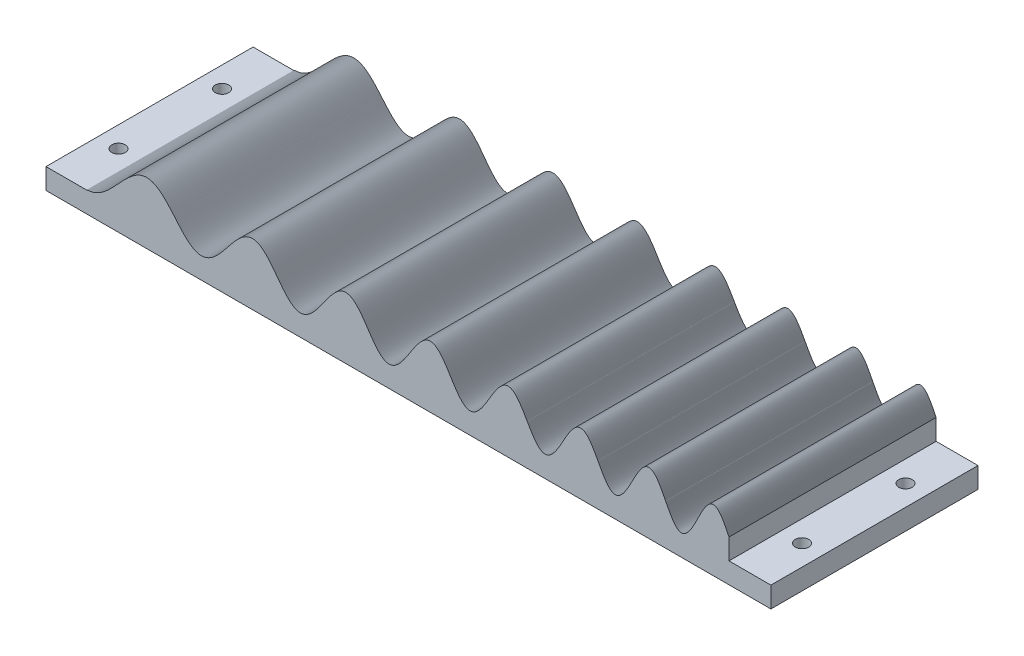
SolidWorks part; units mm, degrees
ref_plane "Front Plane" through (0, 0, 0) normal (0, 0, 1) x (1, 0, 0)
ref_plane "Top Plane" through (0, 0, 0) normal (0, 1, 0) x (1, 0, 0)
ref_plane "Right Plane" through (0, 0, 0) normal (1, 0, 0) x (0, 0, -1)
sketch "Model"
  dimension "D1" = 20
  dimension "D2" = 10
  dimension "D3" = 350
extrude "Boss-Extrude1" add sketch "Model" along normal blind 100
sketch "Sketch2" plane through (0, -10, 0) normal (0, -1, 0) x (1, 0, 0)
  line L0 (155, 100) -> (155, 0) construction
  line L1 (-20, 100) -> (330, 100) construction
  line L2 (-20, 0) -> (330, 0) construction
  line L4 (-20, 100) -> (-20, 0) construction
  line L5 (-20, 50) -> (330, 50) construction
  line L6 (330, 100) -> (330, 0) construction
  circle A0 centre (-10, 75) radius 3.25
  circle A1 centre (320, 75) radius 3.25
  circle A2 centre (320, 25) radius 3.25
  circle A3 centre (-10, 25) radius 3.25
  dimension "D1" = 6.5
  dimension "D2" = 25
  dimension "D3" = 10
extrude "Cut-Extrude1" cut sketch "Sketch2" against normal through all both and the other way through all
